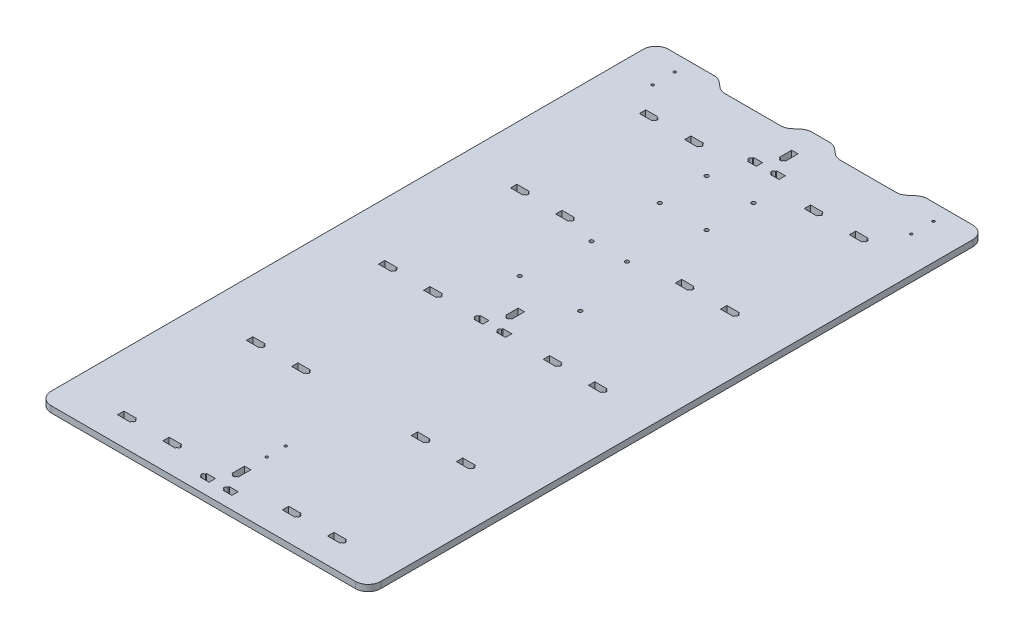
SolidWorks part; units mm, degrees
ref_plane "Plan de face" through (0, 0, 0) normal (0, 0, 1) x (1, 0, 0)
ref_plane "Plan de dessus" through (0, 0, 0) normal (0, 1, 0) x (1, 0, 0)
ref_plane "Plan de droite" through (0, 0, 0) normal (1, 0, 0) x (0, 0, -1)
sketch "Esquisse1" plane through (0, 0, 0) normal (0, 1, 0) x (1, 0, 0)
  line L1 (-130, 218.5) -> (130, 218.5)
  line L2 (-130, 218.5) -> (-130, -218.5)
  line L3 (-130, -218.5) -> (130, -218.5)
  line L4 (130, 218.5) -> (130, -218.5)
  dimension "D1" = 437
  dimension "D2" = 260
  dimension "D3" = 130
  dimension "D4" = 218.5
extrude "Boss.-Extru.1" add sketch "Esquisse1" along normal blind 5
sketch "Esquisse2" plane through (0, 5, 0) normal (0, 1, 0) x (1, 0, 0)
  line L0 (52.34, -204.532) -> (52.34, -203.5)
  line L1 (88, -208.5) -> (78, -208.5)
  line L2 (88, -208.5) -> (88, -207.5309)
  line L3 (88, -203.5) -> (78, -203.5)
  line L4 (78, -208.5) -> (78, -203.5)
  line L5 (42.34, -208.5) -> (52.34, -208.5)
  line L6 (42.34, -208.5) -> (42.34, -203.5)
  line L7 (42.34, -203.5) -> (52.34, -203.5)
  line L8 (52.34, -208.5) -> (52.34, -207.468)
  line L9 (88, -204.4691) -> (88, -203.5)
  line L10 (52.34, -102.8126) -> (52.34, -101.835)
  line L11 (88, -106.835) -> (78, -106.835)
  line L12 (88, -106.835) -> (88, -105.8485)
  line L13 (88, -101.835) -> (78, -101.835)
  line L14 (78, -106.835) -> (78, -101.835)
  line L15 (52.34, -106.835) -> (42.34, -106.835)
  line L16 (52.34, -106.835) -> (52.34, -105.8574)
  line L17 (52.34, -101.835) -> (42.34, -101.835)
  line L18 (42.34, -106.835) -> (42.34, -101.835)
  line L19 (88, -2.67) -> (78, -2.67)
  line L20 (88, -2.67) -> (88, -1.6201)
  line L21 (88, 2.33) -> (78, 2.33)
  line L22 (78, -2.67) -> (78, 2.33)
  line L23 (52.34, -2.67) -> (42.34, -2.67)
  line L24 (52.34, -2.67) -> (52.34, -1.6498)
  line L25 (52.34, 2.33) -> (42.34, 2.33)
  line L26 (42.34, -2.67) -> (42.34, 2.33)
  line L27 (88, 101.495) -> (78, 101.495)
  line L28 (88, 101.495) -> (88, 102.495)
  line L29 (88, 106.495) -> (78, 106.495)
  line L30 (78, 101.495) -> (78, 106.495)
  line L31 (52.34, 101.495) -> (42.34, 101.495)
  line L32 (52.34, 101.495) -> (52.34, 102.495)
  line L33 (52.34, 106.495) -> (42.34, 106.495)
  line L34 (42.34, 101.495) -> (42.34, 106.495)
  line L35 (88, 203.16) -> (78, 203.16)
  line L36 (88, 203.16) -> (88, 204.16)
  line L37 (88, 208.16) -> (78, 208.16)
  line L38 (78, 203.16) -> (78, 208.16)
  line L39 (52.34, 203.16) -> (42.34, 203.16)
  line L40 (52.34, 203.16) -> (52.34, 204.16)
  line L41 (52.34, 208.16) -> (42.34, 208.16)
  line L42 (42.34, 203.16) -> (42.34, 208.16)
  line L43 (88, -102.8215) -> (88, -101.835)
  line L44 (-130, -218.5) -> (130, -218.5) construction
  line L45 (52.34, 1.3098) -> (52.34, 2.33)
  line L46 (88, 1.2801) -> (88, 2.33)
  line L47 (52.34, 105.495) -> (52.34, 106.495)
  line L48 (88, 105.495) -> (88, 106.495)
  line L49 (52.34, 207.16) -> (52.34, 208.16)
  line L50 (88, 207.16) -> (88, 208.16)
  arc A0 (88, 204.16) -> (88, 207.16) centre (88, 205.66) ccw
  arc A1 (52.34, 204.16) -> (52.34, 207.16) centre (52.34, 205.66) ccw
  arc A2 (88, 102.495) -> (88, 105.495) centre (88, 103.995) ccw
  arc A3 (52.34, 102.495) -> (52.34, 105.495) centre (52.34, 103.995) ccw
  arc A4 (52.34, -1.6498) -> (52.34, 1.3098) centre (52.34, -0.17) ccw
  arc A5 (88, -1.6201) -> (88, 1.2801) centre (88, -0.17) ccw
  arc A6 (52.34, -105.8574) -> (52.34, -102.8126) centre (52.34, -104.335) ccw
  arc A7 (88, -105.8485) -> (88, -102.8215) centre (88, -104.335) ccw
  arc A8 (52.34, -207.468) -> (52.34, -204.532) centre (52.34, -206) ccw
  arc A9 (88, -207.5309) -> (88, -204.4691) centre (88, -206) ccw
  dimension "D33" = 3
  dimension "D34" = 3
  dimension "D35" = 3
  dimension "D36" = 3
  dimension "D1" = 5
  dimension "D2" = 10
  dimension "D3" = 5
  dimension "D4" = 10
  dimension "D5" = 25.66
  dimension "D6" = 42.34
  dimension "D7" = 10
  dimension "D8" = 5
  dimension "D9" = 10
  dimension "D10" = 5
  dimension "D11" = 10
  dimension "D12" = 25.66
  dimension "D14" = 5
  dimension "D15" = 10
  dimension "D16" = 5
  dimension "D17" = 10
  dimension "D19" = 5
  dimension "D20" = 10
  dimension "D21" = 5
  dimension "D22" = 10
  dimension "D24" = 5
  dimension "D25" = 10
  dimension "D26" = 5
  dimension "D27" = 10
  dimension "D29" = 42.34
  dimension "D30" = 25.66
  dimension "D31" = 10
  dimension "D32" = 25.66
extrude "Enlèv. mat.-Extru.1" cut sketch "Esquisse2" against normal blind 5
pattern_linear "Répétition linéaire1" count 2 spacing 130 along (-1, 0, 0) of "Enlèv. mat.-Extru.1"
sketch "Esquisse3" plane through (0, 0, 218.5) normal (0, 0, 1) x (1, 0, 0)
  line L1 (130, 5) -> (-130, 5)
  line L2 (130, 5) -> (130, 0)
  line L3 (130, 0) -> (-130, 0)
  line L4 (-130, 5) -> (-130, 0)
  dimension "D1" = 5
  dimension "D2" = 260
extrude "Boss.-Extru.2" add sketch "Esquisse3" along normal blind 10
sketch "Esquisse4" plane through (0, 0, -218.5) normal (0, 0, -1) x (-1, 0, 0)
  line L1 (-130, 0) -> (130, 0)
  line L2 (-130, 0) -> (-130, 5)
  line L3 (-130, 5) -> (130, 5)
  line L4 (130, 0) -> (130, 5)
  dimension "D1" = 5
  dimension "D2" = 260
extrude "Boss.-Extru.3" add sketch "Esquisse4" along normal blind 40
sketch "Esquisse5" plane through (0, 5, 0) normal (0, 1, 0) x (1, 0, 0)
  line L0 (5.5, -217.548) -> (5.5, -218.5)
  line L5 (-12.5, -217.5166) -> (-12.5, -218.5)
  line L10 (130, -228.5) -> (-130, -228.5) construction
  line L15 (-12.5, -213.5) -> (-5.5, -213.5)
  line L16 (-12.5, -213.5) -> (-12.5, -214.4834)
  line L17 (-12.5, -218.5) -> (-5.5, -218.5)
  line L18 (-5.5, -213.5) -> (-5.5, -218.5)
  line L20 (5.5, -213.5) -> (12.5, -213.5)
  line L21 (5.5, -213.5) -> (5.5, -214.452)
  line L22 (5.5, -218.5) -> (12.5, -218.5)
  line L23 (12.5, -213.5) -> (12.5, -218.5)
  arc A0 (5.5, -214.452) -> (5.5, -217.548) centre (5.5, -216) ccw
  arc A1 (-12.5, -214.4834) -> (-12.5, -217.5166) centre (-12.5, -216) ccw
  dimension "D1" = 5
  dimension "D2" = 7
  dimension "D3" = 10
  dimension "D4" = 12.5
  dimension "D5" = 5
  dimension "D6" = 7
  dimension "D7" = 12.5
extrude "Enlèv. mat.-Extru.2" cut sketch "Esquisse5" against normal blind 10
pattern_linear "Répétition linéaire2" count 3 spacing 215.83 along (0, 0, -1) of "Enlèv. mat.-Extru.2"
sketch "Esquisse7" plane through (0, 5, 0) normal (0, 1, 0) x (1, 0, 0)
  line L0 (12.5, 218.16) -> (5.5, 218.16) construction
  line L1 (2.5, 238.16) -> (-2.5, 238.16)
  line L2 (2.5, 238.16) -> (2.5, 228.16)
  line L3 (2.5, 228.16) -> (1.4784, 228.16)
  line L4 (-2.5, 238.16) -> (-2.5, 228.16)
  line L6 (-1.4784, 228.16) -> (-2.5, 228.16)
  arc A0 (-1.4784, 228.16) -> (1.4784, 228.16) centre (0, 228.16) ccw
  dimension "D1" = 10
  dimension "D2" = 5
  dimension "D4" = 10
extrude "Enlèv. mat.-Extru.3" cut sketch "Esquisse7" against normal blind 10
pattern_linear "Répétition linéaire3" count 3 spacing 215.83 along (0, 0, 1) of "Enlèv. mat.-Extru.3"
sketch "Esquisse8" plane through (0, 0, 0) normal (0, -1, 0) x (1, 0, 0)
  circle A0 centre (-18.5, -150) radius 1.5
  circle A1 centre (18.5, -150) radius 1.5
  circle A2 centre (-18.5, -187) radius 1.5
  circle A3 centre (18.5, -187) radius 1.5
  dimension "D1" = 3
  dimension "D2" = 3
  dimension "D5" = 3
  dimension "D6" = 3
  dimension "D12" = 18.5
  dimension "D3" = 37
  dimension "D4" = 18.5
  dimension "D7" = 37
  dimension "D8" = 37
  dimension "D9" = 150
  dimension "D10" = 37
  dimension "D11" = 52.3259
extrude "Enlèv. mat.-Extru.4" cut sketch "Esquisse8" against normal blind 10
sketch "Esquisse9" plane through (0, 0, 0) normal (0, -1, 0) x (1, 0, 0)
  line L1 (-130, -258.5) -> (130, -258.5) construction
  circle A2 centre (102, -245.5) radius 1
  circle A3 centre (102, -228) radius 1
  circle A4 centre (-102, -245.5) radius 1
  circle A5 centre (-102, -228) radius 1
  dimension "D1" = 13
  dimension "D2" = 2
  dimension "D3" = 17.5
  dimension "D4" = 2
  dimension "D5" = 2
  dimension "D6" = 204
  dimension "D7" = 2
  dimension "D8" = 17.5
fillet "Congé2" radius 10 4 edges at (130, 2.5, 228.5) (-130, 2.5, 228.5) (-130, 2.5, -258.5) (130, 2.5, -258.5)
sketch "Esquisse10" plane through (0, 5, 0) normal (0, 1, 0) x (1, 0, 0)
  line L0 (80.5, 258.5) -> (70.966, 250.5)
  line L1 (70.966, 250.5) -> (20.034, 250.5)
  line L2 (20.034, 250.5) -> (10.5, 258.5)
  line L3 (10.5, 258.5) -> (80.5, 258.5)
  line L4 (-120, 258.5) -> (120, 258.5) construction
  dimension "D1" = 8
  dimension "D2" = 70
  dimension "D3" = 140
  dimension "D4" = 140
extrude "Enlèv. mat.-Extru.6" cut sketch "Esquisse10" against normal blind 10
fillet "Congé3" radius 10 4 edges at (10.5, 2.5, -258.5) (20.034, 2.5, -250.5) (70.966, 2.5, -250.5) (80.5, 2.5, -258.5)
mirror "Symétrie2" about plane through (0, 0, 0) normal (1, 0, 0) of "Enlèv. mat.-Extru.6", "Congé3"
extrude "Enlèv. mat.-Extru.9" cut sketch "Esquisse9" against normal blind 5
sketch "Esquisse12" plane through (0, 5, 0) normal (0, 1, 0) x (1, 0, 0)
  circle A0 centre (23.9, 45) radius 1.5
  circle A1 centre (-23.9, 45) radius 1.5
  circle A2 centre (-19.2, 97) radius 1.5
  circle A3 centre (8.7, 97) radius 1.5
  dimension "D1" = 3
  dimension "D2" = 3
  dimension "D3" = 47.8
  dimension "D7" = 3
  dimension "D8" = 4.7
  dimension "D9" = 3
  dimension "D10" = 27.9
  dimension "D11" = 52
  dimension "D4" = 23.9
  dimension "D5" = 45
  dimension "D6" = 45
extrude "Enlèv. mat.-Extru.10" cut sketch "Esquisse12" against normal blind 6
sketch "Esquisse13" plane through (0, 5, 0) normal (0, 1, 0) x (1, 0, 0)
  line L0 (120, -228.5) -> (-120, -228.5) construction
  circle A0 centre (0, -178.5) radius 1
  circle A1 centre (0, -163.5) radius 1
  dimension "D1" = 2
  dimension "D2" = 2
  dimension "D3" = 15
  dimension "D4" = 50
extrude "Enlèv. mat.-Extru.11" cut sketch "Esquisse13" against normal blind 10
